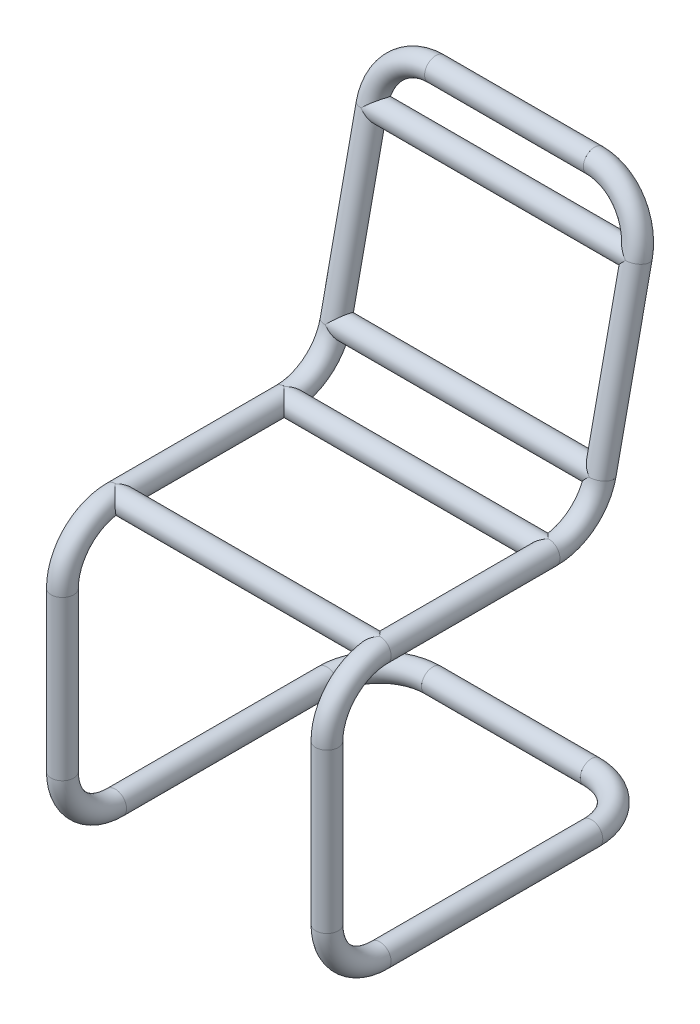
SolidWorks part; units mm, degrees
other "DetailItem1"
other "DetailItem2"
other "DetailItem3"
other "DetailItem4"
other "DetailItem5"
other "DetailItem6"
other "DetailItem7"
other "DetailItem8"
other "Weld Folder"
other "Weld Bead1"
other "Weld Bead2"
other "Weld Bead3"
other "Weld Bead4"
other "Weld Bead5"
other "Weld Bead6"
other "Weld Bead7"
other "Weld Bead8"
ref_plane "Front Plane" through (0, 0, 0) normal (0, 0, 1) x (1, 0, 0)
ref_plane "Top Plane" through (0, 0, 0) normal (0, 1, 0) x (1, 0, 0)
ref_plane "Right Plane" through (0, 0, 0) normal (1, 0, 0) x (0, 0, -1)
ref_plane "Plane2" through (125, 0, 0) normal (1, 0, 0) x (0, 0, -1)
sketch "Sketch3" plane through (125, 0, 0) normal (1, 0, 0) x (0, 0, -1)
  line L0 (250, -250) -> (50, -250)
  line L1 (0, -200) -> (0, -50)
  line L2 (50, 0) -> (209.5108, 0)
  line L3 (258.4182, 39.6044) -> (292.5113, 200)
  arc A0 (258.4182, 39.6044) -> (209.5108, 0) centre (209.5108, 50) cw
  arc A1 (0, -50) -> (50, 0) centre (50, -50) cw
  arc A2 (0, -200) -> (50, -250) centre (50, -200) ccw
  point P9 (250, 0)
  point P12 (0, 0)
  point P15 (0, -250)
  dimension "D5" = 50
  dimension "D1" = 102
  dimension "D2" = 250
  dimension "D3" = 200
  dimension "D4" = 250
  dimension "D6" = 200
ref_plane "Plane3" through (0, -250, 0) normal (0, 1, 0) x (1, 0, 0)
sketch "Sketch4" plane through (0, -250, 0) normal (0, 1, 0) x (1, 0, 0)
  line L0 (-75, 300) -> (75, 300)
  line L1 (125, 250) -> (125, 50) construction
  arc A0 (75, 300) -> (125, 250) centre (75, 250) cw
  arc A1 (-75, 300) -> (-125, 250) centre (-75, 250) ccw
  dimension "D1" = 50
  dimension "D2" = 250
ref_plane "Plane5" through (-125, 0, 0) normal (1, 0, 0) x (0, 0, -1)
sketch "Sketch6" plane through (-125, 0, 0) normal (1, 0, 0) x (0, 0, -1)
  line L0 (250, -250) -> (50, -250) construction
  line L1 (0, -200) -> (0, -50) construction
  line L2 (50, 0) -> (209.5108, 0) construction
  line L3 (258.4182, 39.6044) -> (292.5113, 200) construction
  line L4 (250, -250) -> (50, -250)
  line L5 (0, -200) -> (0, -50)
  line L6 (50, 0) -> (209.5108, 0)
  line L7 (258.4182, 39.6044) -> (292.5113, 200)
  arc A0 (0, -200) -> (50, -250) centre (50, -200) ccw construction
  arc A1 (50, 0) -> (0, -50) centre (50, -50) ccw construction
  arc A2 (209.5108, 0) -> (258.4182, 39.6044) centre (209.5108, 50) ccw construction
  arc A3 (0, -200) -> (50, -250) centre (50, -200) ccw
  arc A4 (50, 0) -> (0, -50) centre (50, -50) ccw
  arc A5 (209.5108, 0) -> (258.4182, 39.6044) centre (209.5108, 50) ccw
ref_plane "Plane6" through (0, -50.8421, -239.1932) normal (0, -0.2079, -0.9781) x (-1, 0, 0)
sketch "Sketch7" plane through (0, -50.8421, -239.1932) normal (0, -0.2079, -0.9781) x (-1, 0, 0)
  line L1 (-75, 306.446) -> (75, 306.446)
  line L2 (125, 92.4671) -> (125, 256.446) construction
  line L3 (-125, 256.446) -> (125, 256.446)
  line L4 (-125, 92.4671) -> (125, 92.4671)
  arc A0 (75, 306.446) -> (125, 256.446) centre (75, 256.446) cw
  arc A1 (-75, 306.446) -> (-125, 256.446) centre (-75, 256.446) ccw
  point P6 (0, 306.446)
  dimension "D1" = 50
  dimension "D2" = 250
ref_plane "Plane7" through (0, 0, 0) normal (0, -1, 0) x (-1, 0, 0)
sketch "Sketch8" plane through (0, 0, 0) normal (0, -1, 0) x (-1, 0, 0)
  line L0 (125, 209.5108) -> (-125, 209.5108)
  line L1 (125, 50) -> (-125, 50)
other "Pipe 21.3 X 2.3(1)"
ref_plane "Plane8" through (-125, 0, -50) normal (0, 0, -1) x (0, 1, 0)
sketch "Sketch1" plane through (-125, 0, -50) normal (0, 0, -1) x (0, 1, 0)
  circle A0 centre (0, 0) radius 8.35
  circle A1 centre (0, 0) radius 10.65
  point P3 (0, 10.65)
  point P5 (-10.65, 0)
  point P6 (0, -10.65)
  point P7 (10.65, 0)
  point P8 (0, 0)
  dimension "In_dia" = 16.7
  dimension "Out_dia" = 21.3
